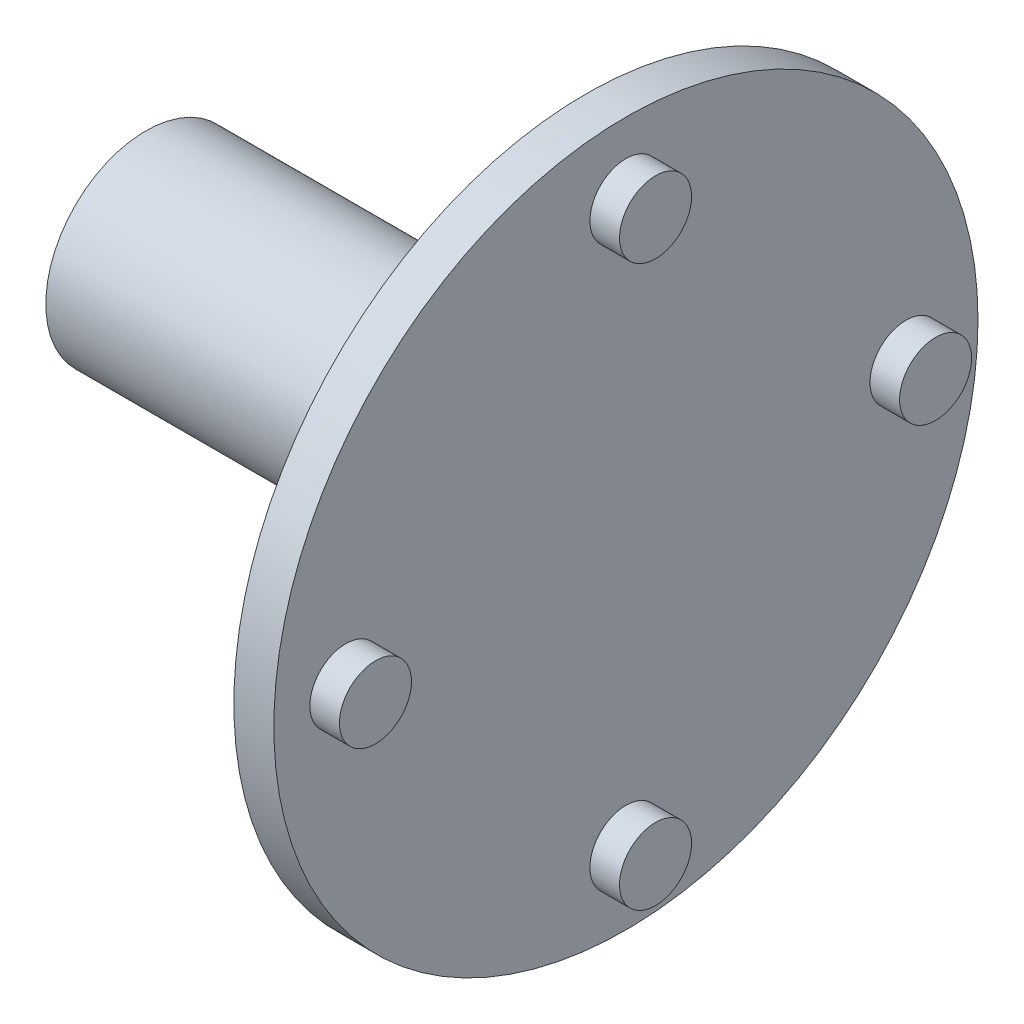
SolidWorks part; units mm, degrees
ref_plane "Front Plane" through (0, 0, 0) normal (0, 0, 1) x (1, 0, 0)
ref_plane "Top Plane" through (0, 0, 0) normal (0, 1, 0) x (1, 0, 0)
ref_plane "Right Plane" through (0, 0, 0) normal (1, 0, 0) x (0, 0, -1)
sketch "Sketch1" plane through (0, 0, 0) normal (1, 0, 0) x (0, 0, -1)
  line L0 (0, 35) -> (0, -35) construction
  line L1 (35, 0) -> (-35, 0) construction
  circle A0 centre (0, 0) radius 44 construction
  circle A1 centre (0, 0) radius 35 construction
  circle A2 centre (0, 35) radius 4.5
  circle A3 centre (35, 0) radius 4.5
  circle A4 centre (0, -35) radius 4.5
  circle A5 centre (-35, 0) radius 4.5
  point P6 (0, 0)
  point P10 (0, 0)
  point P20 (0, 0)
  dimension "D1" = 88
  dimension "D2" = 70
  dimension "D3" = 9
  dimension "D4" = 4
ref_plane "Plane1" through (-1.7, 0, 0) normal (1, 0, 0) x (0, 0, -1)
sketch "Sketch2" plane through (-1.7, 0, 0) normal (1, 0, 0) x (0, 0, -1)
  circle A0 centre (0, 0) radius 44
  dimension "D1" = 88
sketch "Sketch3" plane through (-1.7, 0, 0) normal (1, 0, 0) x (0, 0, -1)
  circle A1 centre (0, 0) radius 12.5
  dimension "D1" = 25
extrude "Boss-Extrude1" add sketch "Sketch3" against normal blind 60
extrude "Boss-Extrude2" add sketch "Sketch2" against normal blind 5 contours A0
extrude "Boss-Extrude3" add sketch "Sketch1" along normal mid plane 4 separate body
